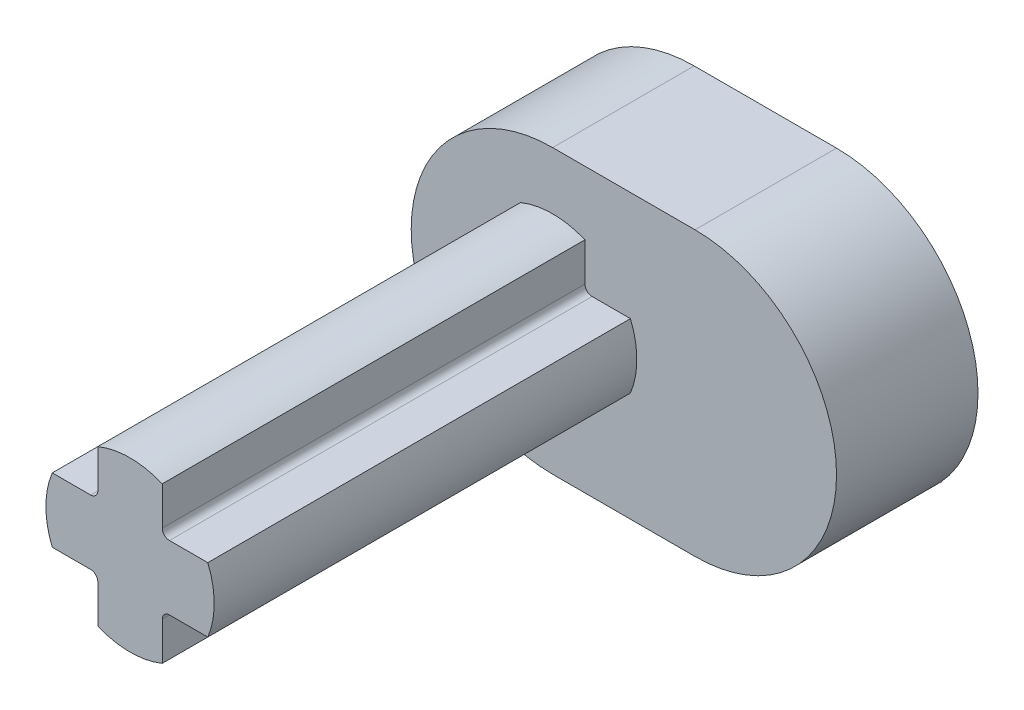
SolidWorks part; units mm, degrees
ref_plane "Plano1" through (0, 0, 0) normal (0, 0, 1) x (1, 0, 0)
ref_plane "Plano2" through (0, 0, 0) normal (0, 1, 0) x (1, 0, 0)
ref_plane "Plano3" through (0, 0, 0) normal (1, 0, 0) x (0, 0, -1)
sketch "Sketch1" plane through (0, 0, 0) normal (0, 0, 1) x (1, 0, 0)
  line L1 (3.975, 3.95) -> (0, 3.95)
  line L2 (3.975, -3.95) -> (0, -3.95)
  arc A0 (0, 3.95) -> (0, -3.95) centre (0, 0) ccw
  arc A1 (3.975, -3.95) -> (3.975, 3.95) centre (3.975, 0) ccw
  dimension "D1" = 7.9
  dimension "D2" = 3.975
extrude "Base-Extrude" add sketch "Sketch1" along normal blind 3.95
sketch "Sketch7" plane through (0, 0, 0) normal (0, 0, -1) x (-1, 0, 0)
  line L2 (-1.2988, 1.9584) -> (-1.2988, -1.9584)
  line L3 (0, 0) -> (6.2313, 0) construction
  arc A0 (-1.2988, -1.9584) -> (-1.2988, 1.9584) centre (0, 0) ccw
  arc A1 (0, -3.95) -> (0, 3.95) centre (0, 0) ccw construction
  dimension "D1" = 4.7
extrude "Cut-Extrude3" cut sketch "Sketch7" against normal blind 3.9
sketch "Sketch8" plane through (1.8439, 2.1258, 3.9) normal (0, 0, -1) x (0, 1, 0)
  text T0 "©LEGO" font "Zurich LtCn BT" height in points 2
extrude "Boss-Extrude3" add sketch "Sketch8" along normal blind 0.05
sketch "Sketch9" plane through (0, 0, 0) normal (0, 0, -1) x (-1, 0, 0)
  line L0 (-10.3974, 0) -> (0.9998, 0) construction
  line L1 (-3.975, 3.3629) -> (-3.975, -4.7295) construction
  line L2 (-6.1458, 0.9) -> (-4.875, 0.9)
  line L3 (-6.1458, -0.9) -> (-4.875, -0.9)
  line L4 (-4.875, 2.1708) -> (-4.875, 0.9)
  line L5 (-3.075, 2.1708) -> (-3.075, 0.9)
  line L6 (-3.075, 0.9) -> (-1.8042, 0.9)
  line L7 (-3.075, -0.9) -> (-3.075, -2.1708)
  line L8 (-4.875, -0.9) -> (-4.875, -2.1708)
  line L9 (-3.075, -0.9) -> (-1.8042, -0.9)
  arc A0 (-3.075, 2.1708) -> (-4.875, 2.1708) centre (-3.975, 0) ccw
  arc A1 (-6.1458, 0.9) -> (-6.1458, -0.9) centre (-3.975, 0) ccw
  arc A2 (-1.8042, -0.9) -> (-1.8042, 0.9) centre (-3.975, 0) ccw
  arc A3 (-4.875, -2.1708) -> (-3.075, -2.1708) centre (-3.975, 0) ccw
  dimension "D1" = 4.7
  dimension "D2" = 0.9
  dimension "D3" = 1.8
  dimension "D4" = 0.9
  dimension "D5" = 1.8
extrude "Cut-Extrude8" cut sketch "Sketch9" against normal blind 3.85
sketch "Sketch10" plane through (0, 0, 3.95) normal (0, 0, 1) x (1, 0, 0)
  line L0 (-5.1329, 0) -> (4.4142, 0) construction
  line L1 (0, 3.4167) -> (0, -4.9025) construction
  line L2 (-2.1708, 0.9) -> (-1.1, 0.9)
  line L3 (-0.9, 2.1708) -> (-0.9, 1.1)
  line L4 (-2.1708, -0.9) -> (-1.1, -0.9)
  line L5 (0.9, 2.1708) -> (0.9, 1.1)
  line L6 (-0.9, -1.1) -> (-0.9, -2.1708)
  line L7 (0.9, -1.1) -> (0.9, -2.1708)
  line L8 (1.1, 0.9) -> (2.1708, 0.9)
  line L9 (1.1, -0.9) -> (2.1708, -0.9)
  arc A0 (0.9, 2.1708) -> (-0.9, 2.1708) centre (0, 0) ccw
  arc A1 (-2.1708, 0.9) -> (-2.1708, -0.9) centre (0, 0) ccw
  arc A2 (2.1708, -0.9) -> (2.1708, 0.9) centre (0, 0) ccw
  arc A3 (-0.9, -2.1708) -> (0.9, -2.1708) centre (0, 0) ccw
  arc A4 (-0.9, -1.1) -> (-1.1, -0.9) centre (-1.1, -1.1) ccw
  arc A5 (1.1, -0.9) -> (0.9, -1.1) centre (1.1, -1.1) ccw
  arc A6 (0.9, 1.1) -> (1.1, 0.9) centre (1.1, 1.1) ccw
  arc A7 (-1.1, 0.9) -> (-0.9, 1.1) centre (-1.1, 1.1) ccw
  point P24 (0.9, 0.9)
  dimension "D1" = 4.7
  dimension "D6" = 0.2
  dimension "D2" = 0.9
  dimension "D3" = 1.8
  dimension "D4" = 0.9
  dimension "D5" = 1.8
extrude "Boss-Extrude4" add sketch "Sketch10" along normal blind 11.8
